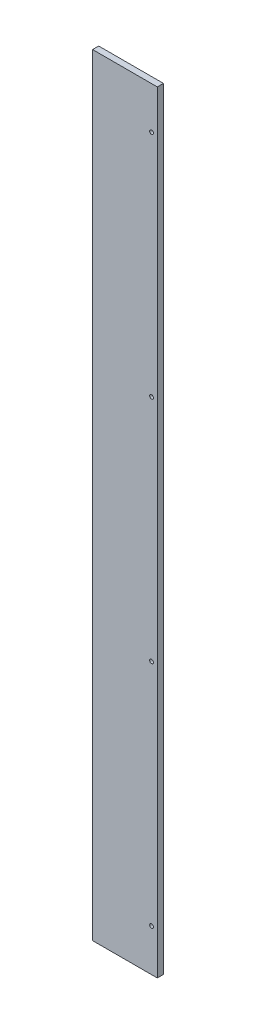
SolidWorks part; units mm, degrees
ref_plane "Спереди" through (0, 0, 0) normal (0, 0, 1) x (1, 0, 0)
ref_plane "Сверху" through (0, 0, 0) normal (0, 1, 0) x (1, 0, 0)
ref_plane "Справа" through (0, 0, 0) normal (1, 0, 0) x (0, 0, -1)
sketch "Эскиз1" plane through (0, 0, 0) normal (0, 0, 1) x (1, 0, 0)
  line L0 (0, 0) -> (84.5, 0) construction
  line L1 (-84.5, 1007.5) -> (84.5, 1007.5)
  line L2 (-84.5, 1007.5) -> (-84.5, -1007.5)
  line L3 (-84.5, -1007.5) -> (84.5, -1007.5)
  line L4 (84.5, 1007.5) -> (84.5, -1007.5)
  line L5 (0, -1007.5) -> (0, 0) construction
  dimension "D1" = 2015
  dimension "D2" = 169
extrude "Бобышка-Вытянуть1" add sketch "Эскиз1" along normal mid plane 16
sketch "Эскиз2" plane through (0, 0, 8) normal (0, 0, 1) x (1, 0, 0)
  line L0 (84.5, -1007.5) -> (84.5, 1007.5) construction
  line L1 (-84.5, -1007.5) -> (84.5, -1007.5) construction
  line L2 (84.5, 1007.5) -> (-84.5, 1007.5) construction
  circle A1 centre (69.5, -299.1667) radius 5
  circle A2 centre (69.5, 299.1667) radius 5
  circle A3 centre (69.5, -897.5) radius 5
  circle A4 centre (69.5, 897.5) radius 5
  dimension "D3" = 10
  dimension "D5" = 110
  dimension "D1" = 15
  dimension "D2" = 110
  dimension "D4" = 4
extrude "Вырез-Вытянуть1" cut sketch "Эскиз2" against normal through all
